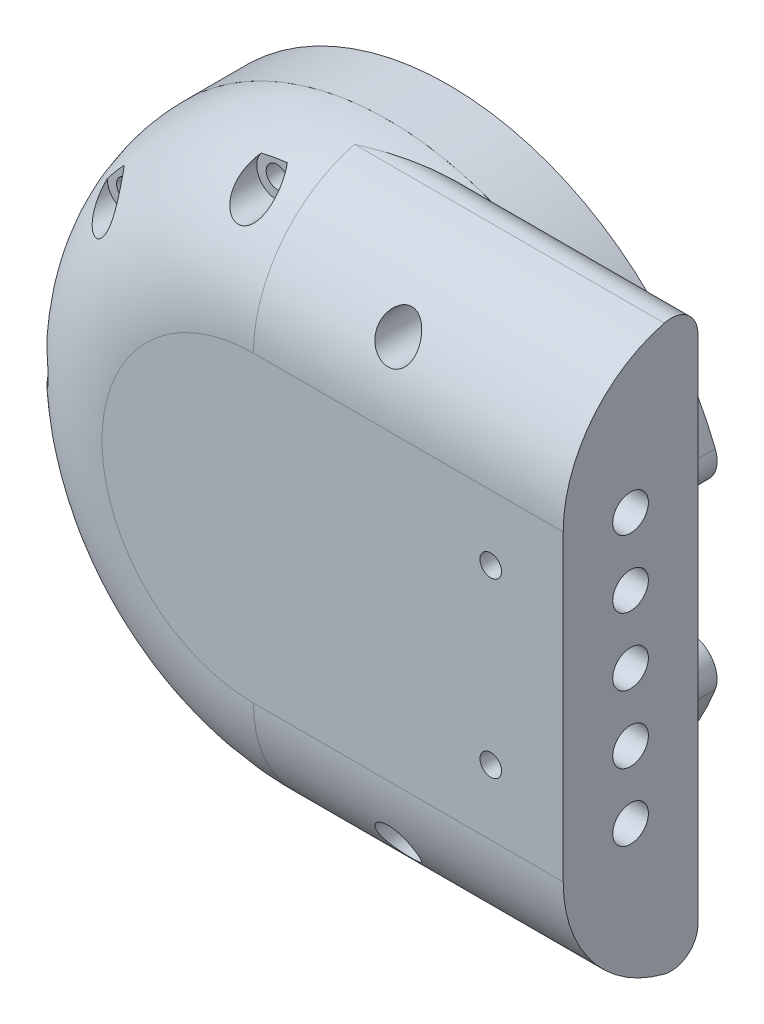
SolidWorks part; units mm, degrees
ref_plane "Front Plane" through (0, 0, 0) normal (0, 0, 1) x (1, 0, 0)
ref_plane "Top Plane" through (0, 0, 0) normal (0, 1, 0) x (1, 0, 0)
ref_plane "Right Plane" through (0, 0, 0) normal (1, 0, 0) x (0, 0, -1)
body saved out of another part "Stock-Hip Adapter-1"
sketch "Sketch1" plane through (46, 0, 0) normal (1, 0, 0) x (0, 0, -1)
  circle A0 centre (-19, 20) radius 2.65
  circle A1 centre (-19, 10) radius 2.65
  circle A2 centre (-19, 0) radius 2.65
  circle A3 centre (-19, -10) radius 2.65
  circle A4 centre (-19, -20) radius 2.65
  dimension "D1" = 5.3
  dimension "D2" = 5.3
  dimension "D3" = 5.3
  dimension "D4" = 5.3
  dimension "D5" = 5.3
extrude "Cut-Extrude1" cut sketch "Sketch1" against normal blind 6
ref_plane "Plane1" through (0, 0, 19) normal (0, 0, 1) x (1, 0, 0)
sketch "Sketch2" plane through (0, 0, 19) normal (0, 0, 1) x (1, 0, 0)
  circle A0 centre (-28.7267, 24.1045) radius 3
  circle A1 centre (-6.5118, 36.9303) radius 3
  circle A2 centre (18.7509, 32.4755) radius 3
  circle A3 centre (18.75, -32.476) radius 3
  circle A4 centre (-6.5118, -36.9303) radius 3
  circle A5 centre (-28.7267, -24.1045) radius 3
  circle A6 centre (-37.5, 0) radius 3
  dimension "D1" = 6
  dimension "D2" = 6
  dimension "D3" = 6
  dimension "D4" = 6
  dimension "D5" = 6
  dimension "D6" = 6
  dimension "D7" = 6
extrude "Cut-Extrude3" cut sketch "Sketch2" along normal through all
split "Split1" bodies to split 104 resulting bodies 105 106
